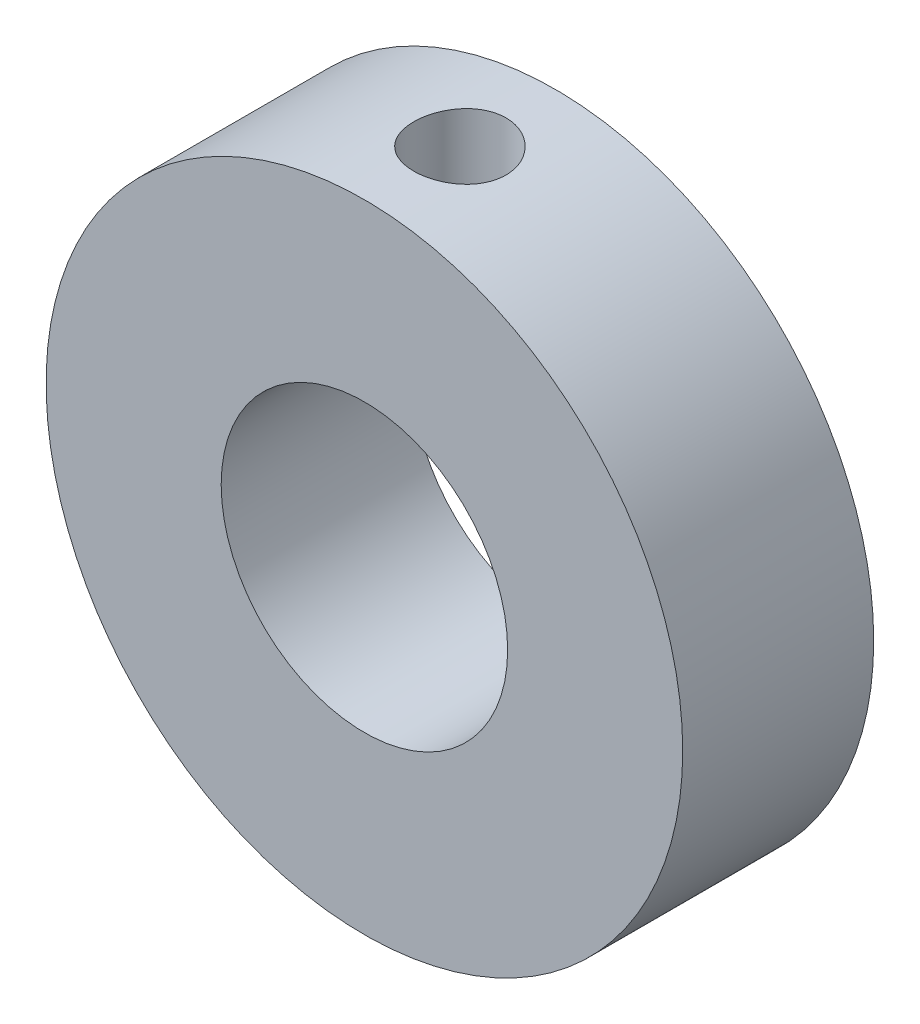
SolidWorks part; units mm, degrees
ref_plane "Face" through (0, 0, 0) normal (0, 0, 1) x (1, 0, 0)
ref_plane "Dessus" through (0, 0, 0) normal (0, 1, 0) x (1, 0, 0)
ref_plane "Droite" through (0, 0, 0) normal (1, 0, 0) x (0, 0, -1)
sketch "Esquisse1" plane through (0, 0, 0) normal (0, 0, 1) x (1, 0, 0)
  circle A0 centre (0, 0) radius 10
  circle A1 centre (0, 0) radius 4.5
  dimension "D1" = 20
  dimension "D2" = 9
extrude "Extrusion1" add sketch "Esquisse1" along normal blind 6
hole_wizard "Trou taraudé M3.5x0.61" positions "Esquisse4" profile "Esquisse3" tap size "M3.5x0.6" standard "ISO"
sketch "Esquisse4" plane through (0, 0, 0) normal (0, 1, 0) x (1, 0, 0)
  line L0 (0, 0) -> (0, -6) construction
  line L1 (-10, -6) -> (10, -6) construction
  point P0 (0, -3)
sketch "Esquisse3" plane through (0, 0, 3) normal (1, 0, 0) x (0, 0, -1)
  line L0 (0, 0) -> (0, 10)
  line L1 (0, 10) -> (1.45, 10)
  line L2 (1.45, 10) -> (1.45, 0)
  line L5 (1.45, 0) -> (0, 0)
  line L11 (0, -6.35) -> (0, 107.95) construction
  dimension "Diamètre du trou pour taraudage jusqu'au prochain" = 2.9
  dimension "Profondeur du trou pour taraudage jusqu'au prochain" = 10
